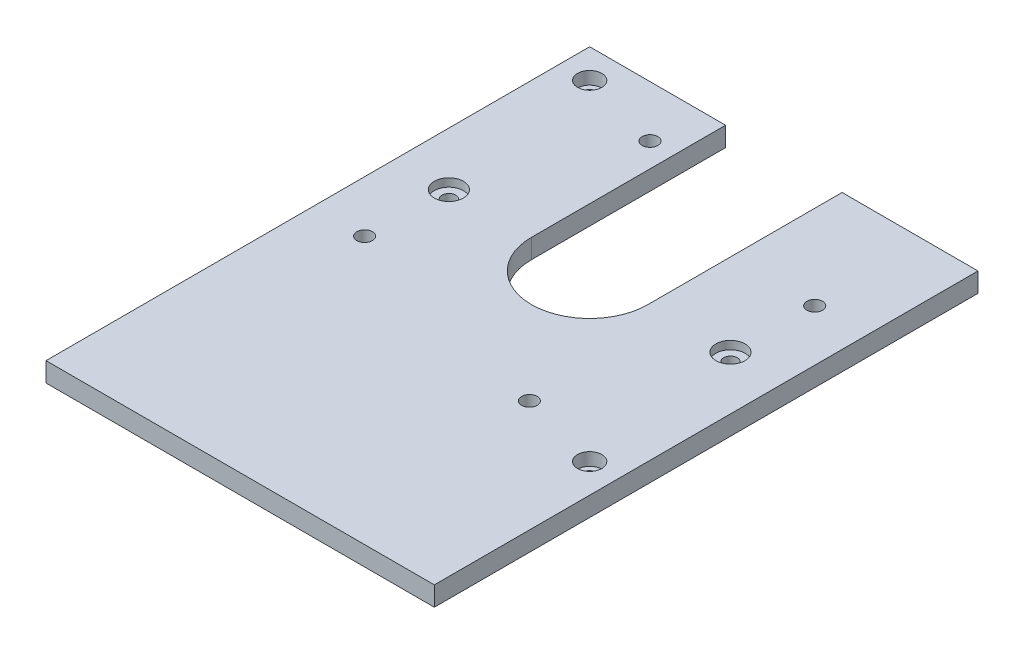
SolidWorks part; units mm, degrees
ref_plane "Front Plane" through (0, 0, 0) normal (0, 0, 1) x (1, 0, 0)
ref_plane "Top Plane" through (0, 0, 0) normal (0, 1, 0) x (1, 0, 0)
ref_plane "Right Plane" through (0, 0, 0) normal (1, 0, 0) x (0, 0, -1)
sketch "Sketch1" plane through (0, 0, 0) normal (0, 1, 0) x (1, 0, 0)
  line L1 (-63.5, -63.5) -> (63.5, -63.5)
  line L2 (-63.5, -63.5) -> (-63.5, 63.5)
  line L3 (-63.5, 63.5) -> (63.5, 63.5)
  line L4 (63.5, -63.5) -> (63.5, 63.5)
  line L5 (-63.5, -63.5) -> (63.5, 63.5) construction
  line L6 (-63.5, 63.5) -> (63.5, -63.5) construction
  point P0 (0, 0)
extrude "Boss-Extrude1" add sketch "Sketch1" along normal blind 6.35
hole_wizard "CBORE for #8 Binding Head Machine Screw1" positions "Sketch2" profile "Sketch3" counterbore size "#8" standard "ANSI Inch"
sketch "Sketch2" plane through (0, 6.35, 0) normal (0, 1, 0) x (1, 0, 0)
  point P0 (-46.0502, 0)
  point P2 (46.0502, 0)
  dimension "D1" = 46.0502
  dimension "D2" = 46.0502
sketch "Sketch3" plane through (-46.0502, 6.35, 0) normal (1, 0, 0) x (0, 0, 1)
  line L0 (0, 0) -> (0, 10.7487)
  line L1 (0, 10.7487) -> (2.2479, 9.398)
  line L2 (2.2479, 9.398) -> (2.2479, 2.667)
  line L3 (2.2479, 2.667) -> (4.7625, 2.667)
  line L4 (4.7625, 2.667) -> (4.7625, 0)
  line L5 (4.7625, 0) -> (0, 0)
  line L10 (0, 10.7487) -> (-2.2479, 9.398) construction
  line L11 (0, -6.35) -> (0, 107.95) construction
  dimension "Hole Dia." = 4.4958
  dimension "Hole Depth" = 9.398
  dimension "C'Bore Dia." = 9.525
  dimension "C'Bore Depth" = 2.667
  dimension "Drill Angle" = 118
hole_wizard "CBORE for #8 Socket Head Cap Screw1" positions "Sketch4" profile "Sketch5" counterbore size "#8" standard "ANSI Inch"
sketch "Sketch4" plane through (0, 6.35, 0) normal (0, 1, 0) x (1, 0, 0)
  point P0 (-53.975, 53.975)
  point P2 (53.975, -53.975)
  dimension "D1" = 53.975
  dimension "D2" = 53.975
  dimension "D3" = 53.975
  dimension "D4" = 53.975
sketch "Sketch5" plane through (-53.975, 6.35, -53.975) normal (1, 0, 0) x (0, 0, 1)
  line L0 (0, 0) -> (0, 10.7487)
  line L1 (0, 10.7487) -> (2.2479, 9.398)
  line L2 (2.2479, 9.398) -> (2.2479, 4.1656)
  line L3 (2.2479, 4.1656) -> (3.9688, 4.1656)
  line L4 (3.9688, 4.1656) -> (3.9688, 0)
  line L5 (3.9688, 0) -> (0, 0)
  line L10 (0, 10.7487) -> (-2.2479, 9.398) construction
  line L11 (0, -6.35) -> (0, 107.95) construction
  dimension "Hole Dia." = 4.4958
  dimension "Hole Depth" = 9.398
  dimension "C'Bore Dia." = 7.9375
  dimension "C'Bore Depth" = 4.1656
  dimension "Drill Angle" = 118
hole_wizard "1/4-20 Tapped Hole1" positions "Sketch6" profile "Sketch7" tap size "1/4-20" standard "ANSI Inch"
sketch "Sketch6" plane through (0, 6.35, 0) normal (0, 1, 0) x (1, 0, 0)
  arc A0 (-53.8782, 0) -> (-46.6599, -26.9391) centre (0, 0) ccw
  arc A1 (0, -53.88) -> (26.94, -46.6615) centre (0, 0) ccw
  arc A2 (53.881, 0) -> (46.6623, 26.9405) centre (0, 0) ccw
  arc A3 (0, 53.881) -> (-26.9405, 46.6623) centre (0, 0) ccw
  point P2 (-46.6599, -26.9391)
  point P6 (26.94, -46.6615)
  point P10 (46.6623, 26.9405)
  point P13 (-26.9405, 46.6623)
sketch "Sketch7" plane through (-26.9405, 6.35, -46.6623) normal (1, 0, 0) x (0, 0, 1)
  line L0 (0, 0) -> (0, 18.0438)
  line L1 (0, 18.0438) -> (2.5527, 16.51)
  line L2 (2.5527, 16.51) -> (2.5527, 0)
  line L5 (2.5527, 0) -> (0, 0)
  line L10 (0, 18.0438) -> (-2.5527, 16.51) construction
  line L11 (0, -6.35) -> (0, 107.95) construction
  dimension "Tap Drill Dia." = 5.1054
  dimension "Tap Drill Depth" = 16.51
  dimension "Drill Angle" = 118
sketch "Sketch8" plane through (0, 6.35, 0) normal (0, 1, 0) x (1, 0, 0)
  line L0 (-19.05, 0) -> (-19.05, 63.5)
  line L1 (63.5, 63.5) -> (-63.5, 63.5) construction
  line L2 (-19.05, 63.5) -> (19.05, 63.5)
  line L3 (19.05, 63.5) -> (19.05, 0)
  line L4 (19.05, 0) -> (-19.05, 0)
  circle A0 centre (0, 0) radius 19.05
extrude "Cut-Extrude1" cut sketch "Sketch8" against normal through all contours A0 L3 L0 M10 | L4 A0 | L4 A0
sketch "Sketch9" plane through (0, 0, 63.5) normal (0, 0, 1) x (1, 0, 0)
  line L1 (-63.5, 6.35) -> (63.5, 6.35)
  line L2 (-63.5, 6.35) -> (-63.5, 0)
  line L3 (-63.5, 0) -> (63.5, 0)
  line L4 (63.5, 6.35) -> (63.5, 0)
extrude "Boss-Extrude2" add sketch "Sketch9" along normal blind 50.8
